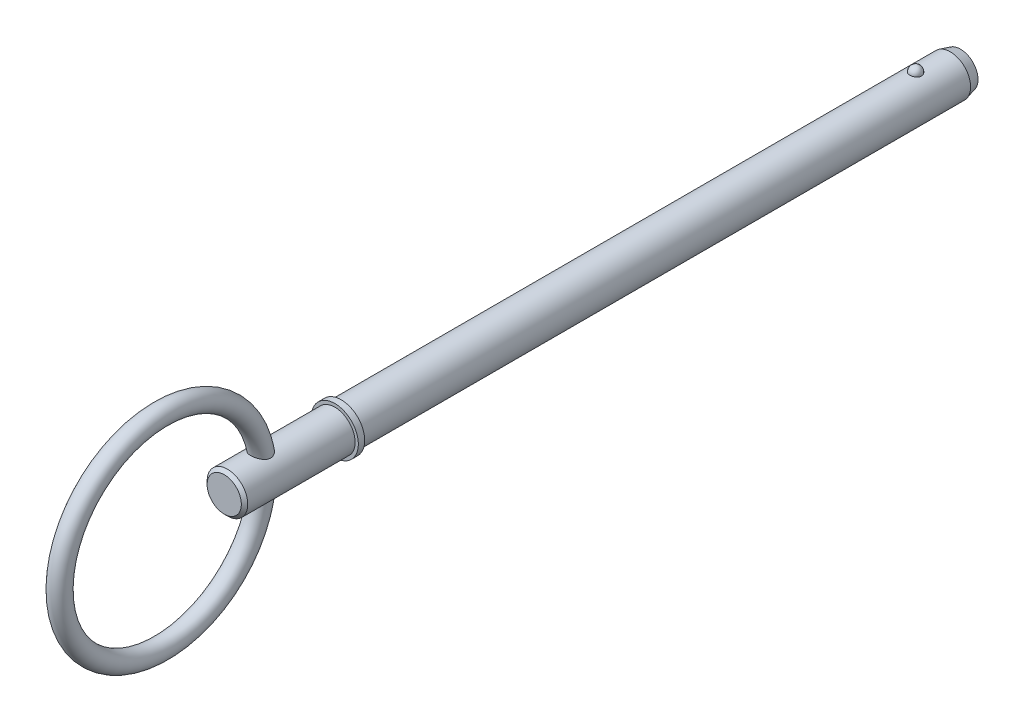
SolidWorks part; units mm, degrees
ref_plane "Front Plane" through (0, 0, 0) normal (0, 0, 1) x (1, 0, 0)
ref_plane "Top Plane" through (0, 0, 0) normal (0, 1, 0) x (1, 0, 0)
ref_plane "Right Plane" through (0, 0, 0) normal (1, 0, 0) x (0, 0, -1)
sketch "Sketch2" plane through (0, 0, 0) normal (0, 0, 1) x (1, 0, 0)
  circle A0 centre (0, 0) radius 3.175
  point P3 (0, 3.175)
  dimension "D1" = 6.35
extrude "Boss-Extrude1" add sketch "Sketch2" along normal blind 88.9
sketch "Sketch3" plane through (0, 0, 0) normal (0, 0, -1) x (-1, 0, 0)
  circle A0 centre (0, 0) radius 3.175
  dimension "D1" = 6.35
extrude "Boss-Extrude2" add sketch "Sketch3" along normal blind 7.92
chamfer "Chamfer1" distance 1.586 angle 15 1 edges at (-3.175, 0, -7.92)
sketch "Sketch18" plane through (0, 0, 0) normal (1, 0, 0) x (0, 0, -1)
  line L0 (6.334, 3.175) -> (-88.9, 3.175) construction
  line L1 (0.91, 4.085) -> (0.91, 2.265)
  line L2 (-88.9, -3.175) -> (6.334, -3.175) construction
  arc A0 (0.91, 4.085) -> (0.91, 2.265) centre (0.91, 3.175) ccw
  point P4 (0, 3.175)
  dimension "D1" = 7.26
revolve "Revolve1" add sketch "Sketch18" angle 360 about L1
sketch "Sketch19" plane through (0, 0, 0) normal (1, 0, 0) x (0, 0, -1)
  line L0 (-33.7288, 0) -> (-46.4542, 0) construction
sketch "Sketch20" plane through (0, 0, 0) normal (1, 0, 0) x (0, 0, -1)
  line L0 (-88.9, 0) -> (-88.9, 3.675)
  line L1 (-88.9, 3.175) -> (-88.9, -3.175) construction
  line L2 (-88.9, 3.675) -> (-89.9, 3.675)
  line L3 (-89.9, 3.675) -> (-89.9, 0)
  line L4 (-33.7288, 0) -> (-46.4542, 0) construction
  line L5 (-89.9, 0) -> (-88.9, 0)
  dimension "D1" = 3.675
  dimension "D2" = 1
revolve "Revolve2" add sketch "Sketch20" angle 360 about L0
sketch "Sketch21" plane through (0, 0, 88.9) normal (0, 0, -1) x (-1, 0, 0)
  circle A0 centre (0, 0) radius 3.175
  dimension "D1" = 6.35
extrude "Boss-Extrude3" add sketch "Sketch21" against normal blind 18.29
chamfer "Chamfer2" distance 0.5 angle 45 1 edges at (-3.175, 0, 107.19)
sketch "Sketch23" plane through (0, 0, 0) normal (1, 0, 0) x (0, 0, -1)
  line L0 (-107.19, 2.675) -> (-107.19, -2.675) construction
  circle A0 centre (-117.065, 0) radius 15.875
  point P2 (-101.19, 0)
  dimension "D1" = 31.75
  dimension "D2" = 6
sketch "Sketch24" plane through (0, 0, 0) normal (0, 1, 0) x (1, 0, 0)
  circle A0 centre (0, -101.19) radius 1.5
  dimension "D1" = 3
sweep "Sweep1" add profiles "Sketch24" path "Sketch23"
